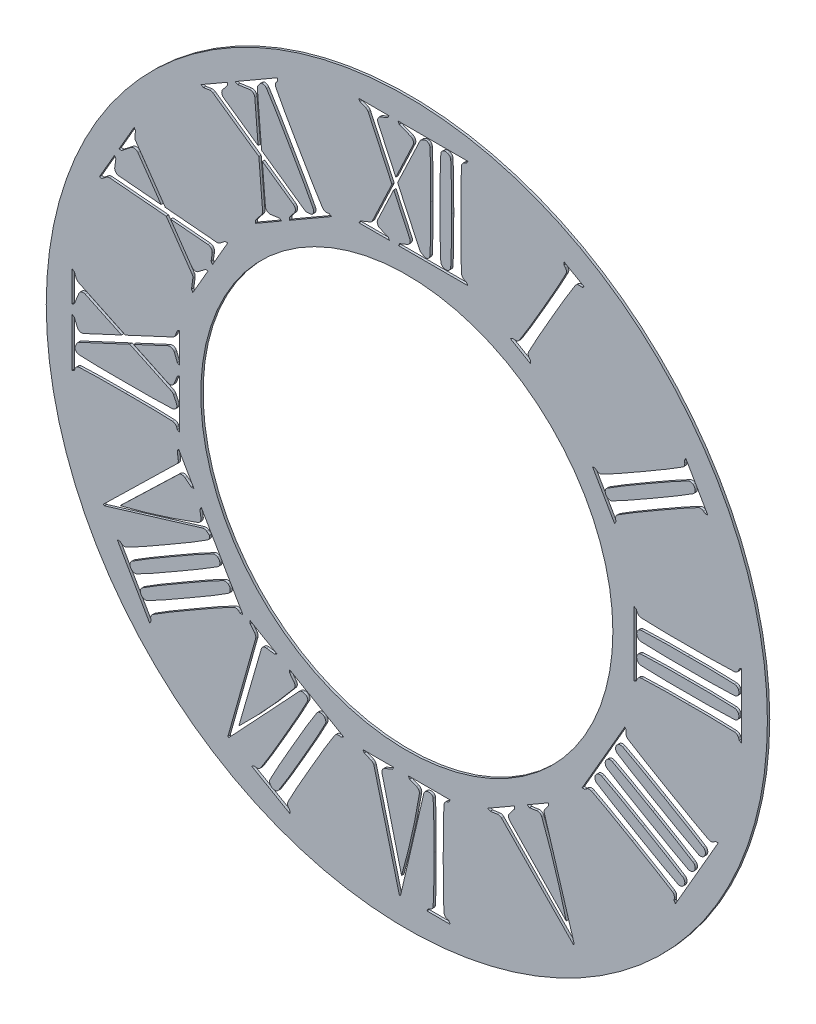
SolidWorks part; units mm, degrees
ref_plane "Спереди" through (0, 0, 0) normal (0, 0, 1) x (1, 0, 0)
ref_plane "Сверху" through (0, 0, 0) normal (0, 1, 0) x (1, 0, 0)
ref_plane "Справа" through (0, 0, 0) normal (1, 0, 0) x (0, 0, -1)
sketch "Эскиз2" plane through (0, 0, 0) normal (0, 0, 1) x (1, 0, 0)
  line L0 (0, 0) -> (30, 51.9615) construction
  line L1 (0, 0) -> (0, 77) construction
  line L2 (36.3522, 20.2743) -> (51.3986, 27.9408) construction
  line L3 (0, 0) -> (51.9615, -30) construction
  line L6 (33.5849, 63.1708) -> (33.5849, 62.5935)
  line L17 (37.4151, 60.3821) -> (36.9495, 60.4476)
  line L18 (24.25, 42.0022) -> (35.75, 61.9208) construction
  line L19 (33.5849, 63.1708) -> (37.9151, 60.6708)
  line L20 (22.0849, 43.2522) -> (22.5849, 43.5409)
  line L21 (33.5849, 62.5935) -> (33.8744, 62.223)
  line L22 (22.5849, 43.5409) -> (23.0505, 43.4755)
  line L23 (26.4151, 40.7522) -> (26.4151, 41.3296)
  line L24 (26.4151, 41.3296) -> (26.1256, 41.7001)
  line L25 (37.9151, 60.6708) -> (37.4151, 60.3821)
  line L26 (29.134, 52.4615) -> (30, 51.9615) construction
  line L27 (22.0849, 43.2522) -> (26.4151, 40.7522)
  line L28 (29, 49.5046) -> (29, 54.6308) construction
  line L29 (30.2438, 54.3838) -> (27.6807, 49.9445) construction
  line L30 (19.4297, 36.8398) -> (28.627, 51.0024) construction
  line L31 (40.8966, 26.1651) -> (60.8152, 37.6651) construction
  line L32 (62.0652, 35.5) -> (61.4878, 35.5) construction
  line L33 (39.6466, 28.3301) -> (42.1466, 24) construction
  line L34 (61.4878, 35.5) -> (61.1173, 35.7895) construction
  line L35 (59.5652, 39.8301) -> (59.2765, 39.3301)
  line L36 (40.2239, 28.3301) -> (40.5944, 28.0407)
  line L37 (42.1466, 24) -> (42.4352, 24.5) construction
  line L38 (39.6466, 28.3301) -> (40.2239, 28.3301)
  line L39 (59.2765, 39.3301) -> (59.3419, 38.8645)
  line L40 (42.4352, 24.5) -> (42.3698, 24.9656) construction
  line L41 (59.5652, 39.8301) -> (62.0652, 35.5) construction
  line L42 (50.3559, 32.7811) -> (50.8559, 31.9151) construction
  line L43 (28.134, 104.2991) -> (28.134, 109.4252) construction
  line L44 (41.8579, 24.5) -> (44.3579, 20.1699) construction
  line L45 (44.3579, 20.1699) -> (44.6466, 20.6699)
  line L46 (43.1079, 22.3349) -> (63.0265, 33.8349) construction
  line L47 (61.7765, 36) -> (64.2765, 31.6699) construction
  line L48 (61.7765, 36) -> (61.4878, 35.5) construction
  line L49 (63.6991, 31.6699) -> (63.3286, 31.9593)
  line L50 (42.4352, 24.5) -> (42.8057, 24.2105) construction
  line L51 (44.6466, 20.6699) -> (44.5811, 21.1355)
  line L52 (64.2765, 31.6699) -> (63.6991, 31.6699)
  line L53 (52.5672, 28.951) -> (53.0672, 28.0849) construction
  line L54 (41.8579, 24.5) -> (42.4352, 24.5) construction
  line L55 (61.4878, 35.5) -> (61.5532, 35.0344) construction
  line L56 (39.6466, 28.3301) -> (44.3579, 20.1699)
  line L57 (59.5652, 39.8301) -> (64.2765, 31.6699)
  line L58 (51.3559, 31.049) -> (52.5672, 28.951) construction
  line L59 (0, 0) -> (51.9615, 30) construction
  line L60 (51.4573, 28.3102) -> (55.8967, 30.8733) construction
  line L61 (49.246, 32.1403) -> (53.6854, 34.7034) construction
  line L62 (0, 0) -> (60, 0) construction
  line L63 (48.5, 2.5) -> (48.5, -2.5) construction
  line L64 (71.5, 2.5) -> (71.5, -2.5) construction
  line L65 (48.5, 0) -> (71.5, 0) construction
  line L66 (60, 1) -> (60, -1) construction
  line L67 (48.5, 2.5) -> (49, 2.2113) construction
  line L68 (49, 2.2113) -> (49.1761, 1.7754) construction
  line L69 (63.17, 1) -> (56.8288, 1) construction
  line L70 (59.7212, 0.6446) -> (34.8048, 1.9504) construction
  line L71 (71, 2.2113) -> (70.8239, 1.7754) construction
  line L72 (71.5, 2.5) -> (71, 2.2113) construction
  line L73 (71.5, -2.5) -> (71, -2.2113) construction
  line L74 (71, -2.2113) -> (70.8239, -1.7754) construction
  line L75 (59, -2.4569) -> (59, 2.6692) construction
  line L76 (49, -2.2113) -> (49.1761, -1.7754) construction
  line L77 (48.5, -2.5) -> (49, -2.2113) construction
  line L78 (34.1408, 24.1044) -> (49.1873, 31.7709) construction
  line L79 (49.1362, 29.7675) -> (53.5755, 32.3306) construction
  line L80 (71, 2.2113) -> (70.8239, 2.6473) construction
  line L81 (48.5, 4.4226) -> (71.5, 4.4226) construction
  line L82 (60, 5.4226) -> (60, 3.4226) construction
  line L83 (48.5, 6.9226) -> (48.5, 1.9226) construction
  line L84 (49, 2.2113) -> (49.1761, 2.6473) construction
  line L85 (71.5, 1.9226) -> (71, 2.2113) construction
  line L86 (48.5, 6.9226) -> (49, 6.634)
  line L87 (49, 6.634) -> (49.1761, 6.198)
  line L88 (71.5, 6.9226) -> (71, 6.634)
  line L89 (71.5, 6.9226) -> (71.5, 1.9226) construction
  line L90 (71, 6.634) -> (70.8239, 6.198)
  line L91 (48.5, 1.9226) -> (49, 2.2113) construction
  line L92 (62.5092, 3.9242) -> (37.5928, 2.6184) construction
  line L93 (62.5092, 4.9211) -> (37.5928, 6.2269) construction
  line L94 (62.1137, 5.4226) -> (57.8863, 5.4226) construction
  line L95 (62.1137, 3.4226) -> (57.8863, 3.4226) construction
  line L96 (71.5, -6.9226) -> (71, -6.634)
  line L97 (71, -6.634) -> (70.8239, -6.198)
  line L98 (49, -6.634) -> (49.1761, -6.198)
  line L99 (48.5, -6.9226) -> (49, -6.634)
  line L100 (71.5, 6.9226) -> (71.5, -6.9226)
  line L101 (48.5, 6.9226) -> (48.5, -6.9226)
  line L102 (48.5, -4.4226) -> (71.5, -4.4226) construction
  line L103 (57.4908, -3.9242) -> (82.4072, -2.6184) construction
  line L104 (62.5092, -3.9242) -> (37.5928, -2.6184) construction
  line L105 (62.1137, -3.4226) -> (57.8863, -3.4226) construction
  line L106 (44.3579, -20.1699) -> (44.6466, -20.6699) construction
  line L107 (44.6466, -20.6699) -> (44.5811, -21.1355) construction
  line L108 (42.4352, -24.5) -> (42.8057, -24.2105) construction
  line L109 (42.4352, -24.5) -> (42.3698, -24.9656) construction
  line L110 (42.1466, -24) -> (42.4352, -24.5) construction
  line L111 (41.8579, -24.5) -> (42.4352, -24.5) construction
  line L112 (37.4352, -32.1603) -> (46.5692, -16.3397)
  line L113 (39.6466, -28.3301) -> (40.2239, -28.3301) construction
  line L114 (40.2239, -28.3301) -> (40.5944, -28.0407) construction
  line L115 (0, 0) -> (51.9615, -30) construction
  line L116 (52.5672, -28.951) -> (53.0672, -28.0849) construction
  line L117 (51.3559, -31.049) -> (52.5672, -28.951) construction
  line L118 (50.3559, -32.7811) -> (50.8559, -31.9151) construction
  line L119 (64.2765, -31.6699) -> (63.6991, -31.6699) construction
  line L120 (63.6991, -31.6699) -> (63.3286, -31.9593) construction
  line L121 (43.1079, -22.3349) -> (63.0265, -33.8349) construction
  line L122 (62.0652, -35.5) -> (61.4878, -35.5) construction
  line L123 (61.4878, -35.5) -> (61.5532, -35.0344) construction
  line L124 (61.7765, -36) -> (61.4878, -35.5) construction
  line L125 (61.4878, -35.5) -> (61.1173, -35.7895) construction
  line L126 (40.8966, -26.1651) -> (60.8152, -37.6651) construction
  line L127 (57.3538, -43.6603) -> (66.4878, -27.8397)
  line L128 (59.2765, -39.3301) -> (59.3419, -38.8645) construction
  line L129 (59.5652, -39.8301) -> (59.2765, -39.3301) construction
  line L130 (46.5692, -16.3397) -> (46.8579, -16.8397)
  line L131 (46.8579, -16.8397) -> (46.7925, -17.3053)
  line L132 (66.4878, -27.8397) -> (65.9105, -27.8397)
  line L133 (65.9105, -27.8397) -> (65.54, -28.1292)
  line L134 (57.3538, -43.6603) -> (57.0652, -43.1603)
  line L135 (57.0652, -43.1603) -> (57.1306, -42.6947)
  line L136 (37.4352, -32.1603) -> (38.0126, -32.1603)
  line L137 (38.0126, -32.1603) -> (38.3831, -31.8708)
  line L138 (0, 0) -> (0, -71.5) construction
  line L139 (0, 0) -> (35.75, -61.9208) construction
  circle A0 centre (0, 0) radius 44
  circle A1 centre (0, 0) radius 77
  circle A2 centre (0, 0) radius 48.5 construction
  circle A3 centre (0, 0) radius 71.5 construction
  circle A8 centre (0, 0) radius 60 construction
  arc A9 (23.0505, 43.4755) -> (24.0284, 43.9211) centre (23.1897, 44.4657) ccw
  arc A10 (26.1256, 41.7001) -> (26.0226, 42.7697) centre (26.9136, 42.3157) cw
  arc A11 (33.8744, 62.223) -> (33.9774, 61.1533) centre (33.0864, 61.6073) cw
  arc A12 (36.9495, 60.4476) -> (35.9716, 60.0019) centre (36.8103, 59.4573) ccw
  arc A13 (61.1173, 35.7895) -> (60.0477, 35.8925) centre (60.5016, 35.0015) ccw
  arc A14 (40.5944, 28.0407) -> (41.6641, 27.9377) centre (41.2101, 28.8287) ccw
  arc A15 (59.3419, 38.8645) -> (58.8963, 37.8867) centre (58.3516, 38.7254) cw
  arc A16 (42.3698, 24.9656) -> (42.8154, 25.9434) centre (43.3601, 25.1048) cw
  arc A17 (44.5811, 21.1355) -> (45.0268, 22.1133) centre (45.5714, 21.2746) cw
  arc A18 (61.5532, 35.0344) -> (61.1076, 34.0566) centre (60.563, 34.8952) cw
  arc A19 (42.8057, 24.2105) -> (43.8754, 24.1075) centre (43.4214, 24.9985) ccw
  arc A20 (63.3286, 31.9593) -> (62.259, 32.0623) centre (62.713, 31.1713) ccw
  arc A21 (49.1761, 1.7754) -> (50.051, 1.1514) centre (50.1033, 2.15) ccw
  arc A22 (70.8239, 1.7754) -> (69.949, 1.1514) centre (69.8967, 2.15) cw
  arc A23 (70.8239, -1.7754) -> (69.949, -1.1514) centre (69.8967, -2.15) ccw
  arc A24 (49.1761, -1.7754) -> (50.051, -1.1514) centre (50.1033, -2.15) cw
  arc A25 (70.8239, 6.198) -> (69.949, 5.574) centre (69.8967, 6.5726) cw
  arc A26 (49.1761, 2.6473) -> (50.051, 3.2713) centre (50.1033, 2.2726) cw
  arc A27 (70.8239, 2.6473) -> (69.949, 3.2713) centre (69.8967, 2.2726) ccw
  arc A28 (49.1761, 6.198) -> (50.051, 5.574) centre (50.1033, 6.5726) ccw
  arc A29 (70.8239, -2.6473) -> (69.949, -3.2713) centre (69.8967, -2.2726) cw
  arc A30 (49.1761, -2.6473) -> (50.051, -3.2713) centre (50.1033, -2.2726) ccw
  arc A31 (70.8239, -6.198) -> (69.949, -5.574) centre (69.8967, -6.5726) ccw
  arc A32 (49.1761, -6.198) -> (50.051, -5.574) centre (50.1033, -6.5726) cw
  arc A33 (44.5811, -21.1355) -> (45.0268, -22.1133) centre (45.5714, -21.2746) ccw
  arc A34 (42.8057, -24.2105) -> (43.8754, -24.1075) centre (43.4214, -24.9985) cw
  arc A35 (42.3698, -24.9656) -> (42.8154, -25.9434) centre (43.3601, -25.1048) ccw
  arc A36 (40.5944, -28.0407) -> (41.6641, -27.9377) centre (41.2101, -28.8287) cw
  arc A37 (63.3286, -31.9593) -> (62.259, -32.0623) centre (62.713, -31.1713) cw
  arc A38 (61.5532, -35.0344) -> (61.1076, -34.0566) centre (60.563, -34.8952) ccw
  arc A39 (61.1173, -35.7895) -> (60.0477, -35.8925) centre (60.5016, -35.0015) cw
  arc A40 (59.3419, -38.8645) -> (58.8963, -37.8867) centre (58.3516, -38.7254) ccw
  arc A41 (46.7925, -17.3053) -> (47.2381, -18.2832) centre (47.7827, -17.4445) ccw
  arc A42 (65.54, -28.1292) -> (64.4703, -28.2322) centre (64.9243, -27.3412) cw
  arc A43 (63.7646, -31.2043) -> (63.3189, -30.2264) centre (62.7743, -31.0651) ccw
  arc A44 (45.0171, -20.3804) -> (46.0867, -20.2774) centre (45.6327, -21.1684) cw
  arc A45 (58.906, -39.6196) -> (57.8363, -39.7226) centre (58.2903, -38.8316) cw
  arc A46 (57.1306, -42.6947) -> (56.685, -41.7168) centre (56.1403, -42.5555) ccw
  arc A47 (38.3831, -31.8708) -> (39.4527, -31.7678) centre (38.9988, -32.6588) cw
  arc A48 (40.1585, -28.7957) -> (40.6041, -29.7736) centre (41.1488, -28.9349) ccw
  spline S0 degree 3 poles (42.3698, -24.9656) (42.4103, -24.6778) (42.5455, -24.4139) (42.8057, -24.2105) knots 0 0 0 0 1 1 1 1
  spline S1 degree 3 poles (53.5672, -27.2189) (50.7926, -25.617) (47.3872, -23.6462) (45.0268, -22.1133) knots 0 0 0 0 1 1 1 1
  spline S2 degree 3 poles (50.3559, -32.7811) (47.5813, -31.1792) (44.1718, -29.2154) (41.6641, -27.9377) knots 0 0 0 0 1 1 1 1
  spline S3 degree 3 poles (51.3559, -31.049) (48.5813, -29.4471) (45.1759, -27.4763) (42.8154, -25.9434) knots 0 0 0 0 1 1 1 1
  spline S4 degree 3 poles (30.866, 51.4615) (32.4679, 54.2361) (34.4387, 57.6415) (35.9716, 60.0019) knots 0 0 0 0 1 1 1 1
  spline S5 degree 3 poles (30.866, 51.4615) (29.2641, 48.6869) (27.3004, 45.2775) (26.0226, 42.7697) knots 0 0 0 0 1 1 1 1
  spline S6 degree 3 poles (29.134, 52.4615) (27.5321, 49.6869) (25.5613, 46.2815) (24.0284, 43.9211) knots 0 0 0 0 1 1 1 1
  spline S7 degree 3 poles (29.134, 52.4615) (30.7359, 55.2361) (32.6996, 58.6456) (33.9774, 61.1533) knots 0 0 0 0 1 1 1 1
  spline S8 degree 3 poles (50.3559, 32.7811) (47.5813, 31.1792) (44.1718, 29.2154) (41.6641, 27.9377) knots 0 0 0 0 1 1 1 1
  spline S9 degree 3 poles (51.3559, 31.049) (48.5813, 29.4471) (45.1759, 27.4763) (42.8154, 25.9434) knots 0 0 0 0 1 1 1 1
  spline S10 degree 3 poles (51.3559, 31.049) (54.1305, 32.651) (57.5399, 34.6147) (60.0477, 35.8925) knots 0 0 0 0 1 1 1 1
  spline S11 degree 3 poles (50.3559, 32.7811) (53.1305, 34.383) (56.5358, 36.3538) (58.8963, 37.8867) knots 0 0 0 0 1 1 1 1
  spline S12 degree 3 poles (52.5672, 28.951) (55.3418, 30.5529) (58.7472, 32.5237) (61.1076, 34.0566) knots 0 0 0 0 1 1 1 1
  spline S13 degree 3 poles (53.5672, 27.2189) (50.7926, 25.617) (47.3872, 23.6462) (45.0268, 22.1133) knots 0 0 0 0 1 1 1 1
  spline S14 degree 3 poles (52.5672, 28.951) (49.7926, 27.349) (46.3831, 25.3853) (43.8754, 24.1075) knots 0 0 0 0 1 1 1 1
  spline S15 degree 3 poles (53.5672, 27.2189) (56.3418, 28.8208) (59.7512, 30.7846) (62.259, 32.0623) knots 0 0 0 0 1 1 1 1
  spline S16 degree 3 poles (42.3698, 24.9656) (42.4103, 24.6778) (42.5455, 24.4139) (42.8057, 24.2105) knots 0 0 0 0 1 1 1 1
  spline S17 degree 3 poles (61.1173, 35.7895) (61.3463, 35.6105) (61.5073, 35.3614) (61.5532, 35.0344) knots 0 0 0 0 1 1 1 1
  spline S18 degree 3 poles (50.051, 1.1514) (54.2037, 0.9337) (57.3578, 1) (60, 1) knots 0 0 0 0 1 1 1 1
  spline S19 degree 3 poles (69.949, 1.1514) (65.7963, 0.9337) (62.6422, 1) (60, 1) knots 0 0 0 0 1 1 1 1
  spline S20 degree 3 poles (69.949, -1.1514) (65.7963, -0.9337) (62.6422, -1) (60, -1) knots 0 0 0 0 1 1 1 1
  spline S21 degree 3 poles (50.051, -1.1514) (54.2037, -0.9337) (57.3578, -1) (60, -1) knots 0 0 0 0 1 1 1 1
  spline S22 degree 3 poles (50.051, 5.574) (54.2037, 5.3564) (57.3578, 5.4226) (60, 5.4226) knots 0 0 0 0 1 1 1 1
  spline S23 degree 3 poles (50.051, 3.2713) (54.2037, 3.4889) (57.3578, 3.4226) (60, 3.4226) knots 0 0 0 0 1 1 1 1
  spline S24 degree 3 poles (69.949, 3.2713) (65.7963, 3.4889) (62.6422, 3.4226) (60, 3.4226) knots 0 0 0 0 1 1 1 1
  spline S25 degree 3 poles (69.949, 5.574) (65.7963, 5.3564) (62.6422, 5.4226) (60, 5.4226) knots 0 0 0 0 1 1 1 1
  spline S26 degree 3 poles (49.1761, 1.7754) (49.0673, 2.0449) (49.0524, 2.3411) (49.1761, 2.6473) knots 0 0 0 0 1 1 1 1
  spline S27 degree 3 poles (70.8239, 1.7754) (70.9327, 2.0449) (70.9476, 2.3411) (70.8239, 2.6473) knots 0 0 0 0 1 1 1 1
  spline S28 degree 3 poles (70.8239, -1.7754) (70.9327, -2.0449) (70.9476, -2.3411) (70.8239, -2.6473) knots 0 0 0 0 1 1 1 1
  spline S29 degree 3 poles (69.949, -3.2713) (65.7963, -3.4889) (62.6422, -3.4226) (60, -3.4226) knots 0 0 0 0 1 1 1 1
  spline S30 degree 3 poles (50.051, -3.2713) (54.2037, -3.4889) (57.3578, -3.4226) (60, -3.4226) knots 0 0 0 0 1 1 1 1
  spline S31 degree 3 poles (49.1761, -1.7754) (49.0673, -2.0449) (49.0524, -2.3411) (49.1761, -2.6473) knots 0 0 0 0 1 1 1 1
  spline S32 degree 3 poles (69.949, -5.574) (65.7963, -5.3564) (62.6422, -5.4226) (60, -5.4226) knots 0 0 0 0 1 1 1 1
  spline S33 degree 3 poles (50.051, -5.574) (54.2037, -5.3564) (57.3578, -5.4226) (60, -5.4226) knots 0 0 0 0 1 1 1 1
  spline S34 degree 3 poles (52.5672, -28.951) (49.7926, -27.349) (46.3831, -25.3853) (43.8754, -24.1075) knots 0 0 0 0 1 1 1 1
  spline S35 degree 3 poles (53.5672, -27.2189) (56.3418, -28.8208) (59.7512, -30.7846) (62.259, -32.0623) knots 0 0 0 0 1 1 1 1
  spline S36 degree 3 poles (52.5672, -28.951) (55.3418, -30.5529) (58.7472, -32.5237) (61.1076, -34.0566) knots 0 0 0 0 1 1 1 1
  spline S37 degree 3 poles (61.1173, -35.7895) (61.3463, -35.6105) (61.5073, -35.3614) (61.5532, -35.0344) knots 0 0 0 0 1 1 1 1
  spline S38 degree 3 poles (51.3559, -31.049) (54.1305, -32.651) (57.5399, -34.6147) (60.0477, -35.8925) knots 0 0 0 0 1 1 1 1
  spline S39 degree 3 poles (50.3559, -32.7811) (53.1305, -34.383) (56.5358, -36.3538) (58.8963, -37.8867) knots 0 0 0 0 1 1 1 1
  spline S40 degree 3 poles (55.7785, -23.3888) (53.0039, -21.7869) (49.5985, -19.8161) (47.2381, -18.2832) knots 0 0 0 0 1 1 1 1
  spline S41 degree 3 poles (55.7785, -23.3888) (58.5531, -24.9907) (61.9626, -26.9544) (64.4703, -28.2322) knots 0 0 0 0 1 1 1 1
  spline S42 degree 3 poles (63.7646, -31.2043) (63.7241, -31.4921) (63.5889, -31.756) (63.3286, -31.9593) knots 0 0 0 0 1 1 1 1
  spline S43 degree 3 poles (45.0171, -20.3804) (44.7881, -20.5593) (44.6271, -20.8084) (44.5811, -21.1355) knots 0 0 0 0 1 1 1 1
  spline S44 degree 3 poles (54.7785, -25.1208) (57.5531, -26.7228) (60.9585, -28.6935) (63.3189, -30.2264) knots 0 0 0 0 1 1 1 1
  spline S45 degree 3 poles (54.7785, -25.1208) (52.0039, -23.5189) (48.5945, -21.5552) (46.0867, -20.2774) knots 0 0 0 0 1 1 1 1
  spline S46 degree 3 poles (59.3419, -38.8645) (59.3015, -39.1523) (59.1662, -39.4163) (58.906, -39.6196) knots 0 0 0 0 1 1 1 1
  spline S47 degree 3 poles (40.5944, -28.0407) (40.3654, -28.2196) (40.2044, -28.4687) (40.1585, -28.7957) knots 0 0 0 0 1 1 1 1
  spline S48 degree 3 poles (48.1445, -36.6112) (50.9191, -38.2131) (54.3245, -40.1839) (56.685, -41.7168) knots 0 0 0 0 1 1 1 1
  spline S49 degree 3 poles (49.1445, -34.8792) (51.9191, -36.4811) (55.3286, -38.4448) (57.8363, -39.7226) knots 0 0 0 0 1 1 1 1
  spline S50 degree 3 poles (49.1445, -34.8792) (46.3699, -33.2772) (42.9646, -31.3065) (40.6041, -29.7736) knots 0 0 0 0 1 1 1 1
  spline S51 degree 3 poles (48.1445, -36.6112) (45.3699, -35.0093) (41.9605, -33.0456) (39.4527, -31.7678) knots 0 0 0 0 1 1 1 1
  point P100 (51.9615, 30)
  dimension "D1" = 88
  dimension "D2" = 154
  dimension "D12" = 97
  dimension "D13" = 143
  dimension "D14" = 120
  dimension "D20" = 1
  dimension "D21" = 3
  dimension "D29" = 2
  dimension "D37" = 2
  dimension "D40" = 23
  dimension "D41" = 2
  dimension "D48" = 3
  dimension "D43" = 2
  dimension "D49" = 3
  dimension "D50" = 2
  dimension "D51" = 2
  dimension "D55" = 3
  dimension "D56" = 3
  dimension "D58" = 3
  dimension "D59" = 3
  dimension "D6" = 3
  dimension "D3" = 30
  dimension "D7" = 30
  dimension "D16" = 5
  dimension "D17" = 60
  dimension "D18" = 22
  dimension "D19" = 0.5
  dimension "D22" = 1
  dimension "D23" = 2.15
  dimension "D24" = 30
  dimension "D25" = 2.5
  dimension "D26" = 60
  dimension "D27" = 22
  dimension "D28" = 0.5
  dimension "D30" = 2.15
  dimension "D31" = 1
  dimension "D32" = 23
  dimension "D33" = 2.5
  dimension "D34" = 60
  dimension "D35" = 22
  dimension "D36" = 0.5
  dimension "D38" = 2.15
  dimension "D39" = 1
  dimension "D42" = 5
  dimension "D44" = 60
  dimension "D45" = 22
  dimension "D46" = 0.5
  dimension "D47" = 2.15
  dimension "D52" = 60
  dimension "D53" = 22
  dimension "D54" = 0.5
  dimension "D57" = 4.4226
extrude "Бобышка-Вытянуть1" add sketch "Эскиз2" along normal blind 0.5
sketch "Эскиз3" plane through (0, 0, 0.5) normal (0, 0, 1) x (1, 0, 0)
  line L0 (0, 0) -> (0, -71.5) construction
  line L1 (0, 0) -> (35.75, -61.9208) construction
  line L2 (35.75, -61.9208) -> (35.5732, -62.0976)
  line L3 (20.2308, -46.3756) -> (35.5732, -62.0976)
  line L4 (35.75, -61.9208) -> (29.3692, -40.9192)
  line L5 (34.0343, -58.5022) -> (21.991, -45.9873)
  line L6 (35.75, -61.9208) -> (34.0343, -58.5022) construction
  line L7 (17.296, -46.0171) -> (30.2301, -38.5496) construction
  line L8 (17.296, -46.0171) -> (22.9988, -42.7246)
  line L9 (17.296, -46.0171) -> (17.796, -46.3058)
  line L10 (4.2733, -71.5) -> (4.5619, -71)
  line L11 (22.9988, -42.7246) -> (22.9988, -43.302)
  line L12 (22.9988, -43.302) -> (21.9235, -44.6782)
  line L13 (17.796, -46.3058) -> (19.3759, -46.0837)
  line L14 (25.6835, -41.1746) -> (30.2301, -38.5496)
  line L15 (25.6835, -41.1746) -> (26.1835, -41.4633)
  line L16 (26.1835, -41.4633) -> (27.7579, -41.242)
  line L17 (30.2301, -38.5496) -> (30.2301, -39.127)
  line L18 (30.2301, -39.127) -> (29.538, -40.0128)
  line L19 (-1.35, -71.4873) -> (3.6213, -50.1244)
  line L20 (-1.35, -71.4873) -> (-1.5915, -71.552)
  line L21 (-1.5915, -71.552) -> (-7.0142, -50.2778)
  line L22 (-1.35, -71.4873) -> (-1.35, -48.4812) construction
  line L23 (-1.35, -71.4873) -> (-1.1265, -67.6688) construction
  line L24 (-1.1265, -67.6688) -> (-5.2957, -50.8217)
  line L25 (4.5619, -71) -> (4.9979, -70.8239)
  line L26 (-9.3765, -48.5) -> (5.5585, -48.5) construction
  line L27 (-2.7915, -48.5) -> (-9.3765, -48.5)
  line L28 (-9.3765, -48.5) -> (-9.0878, -49)
  line L29 (-9.0878, -49) -> (-7.6086, -49.5976)
  line L30 (-2.7915, -48.5) -> (-3.0802, -49)
  line L31 (-3.0802, -49) -> (-4.6996, -49.6543)
  line L32 (0.3085, -48.5) -> (5.5585, -48.5)
  line L33 (0.3085, -48.5) -> (0.5972, -49)
  line L34 (0.5972, -49) -> (2.0663, -49.5936)
  line L35 (5.5585, -48.5) -> (5.2698, -49) construction
  line L36 (5.2698, -49) -> (4.2207, -49.4239) construction
  line L37 (6.7732, -48.5) -> (6.7733, -71.5) construction
  line L38 (5.5585, -48.5) -> (9.2733, -48.5)
  line L39 (4.5619, -49) -> (4.9979, -49.1761) construction
  line L40 (8.9846, -49) -> (8.5486, -49.1761)
  line L41 (4.2733, -71.5) -> (9.2733, -71.5)
  line L42 (6.7733, -60) -> (7.7733, -60) construction
  line L43 (9.2733, -71.5) -> (8.9846, -71)
  line L44 (8.9846, -71) -> (8.5486, -70.8239)
  line L45 (7.4039, -60.0137) -> (8.4706, -80.3666) construction
  line L46 (7.7733, -49.7982) -> (7.7733, -70.2018) construction
  line L47 (9.2733, -48.5) -> (8.9846, -49)
  line L48 (4.2733, -48.5) -> (4.5619, -49) construction
  line L49 (0, 0) -> (-35.75, -61.9208) construction
  line L50 (-33.448, -36.6918) -> (-13.4743, -48.2236) construction
  line L51 (-19.4695, -44.7622) -> (-30.9695, -64.6808) construction
  line L52 (-21.6346, -43.5122) -> (-17.3045, -46.0122) construction
  line L53 (-33.1346, -63.4308) -> (-28.8045, -65.9308) construction
  line L54 (-25.2195, -54.7215) -> (-26.0856, -54.2215) construction
  line L55 (-36.5902, -71.0757) -> (-25.7767, -54.4243) construction
  line L56 (-33.1346, -63.4308) -> (-32.6346, -63.1421)
  line L57 (-32.6346, -63.1421) -> (-32.169, -63.2076)
  line L58 (-26.0856, -54.2215) -> (-37.2842, -71.4658) construction
  line L59 (-31.0597, -62.837) -> (-21.0729, -45.5394) construction
  line L60 (-21.6346, -44.0896) -> (-21.3451, -44.4601) construction
  line L61 (-21.6346, -43.5122) -> (-21.6346, -44.0896) construction
  line L62 (-28.8045, -65.9308) -> (-28.8045, -65.3535) construction
  line L63 (-28.8045, -65.3535) -> (-29.0939, -64.983) construction
  line L64 (-17.8045, -46.3009) -> (-18.2701, -46.2355) construction
  line L65 (-17.3045, -46.0122) -> (-17.8045, -46.3009) construction
  line L66 (-17.8045, -45.7236) -> (-13.4743, -48.2236) construction
  line L67 (-13.4743, -48.2236) -> (-13.9743, -48.5122)
  line L68 (-28.8045, -65.3535) -> (-28.3389, -65.4189) construction
  line L69 (-17.8045, -45.7236) -> (-17.8045, -46.3009) construction
  line L70 (-29.3045, -65.6421) -> (-24.9743, -68.1421) construction
  line L71 (-24.9743, -68.1421) -> (-24.9743, -67.5648)
  line L72 (-17.8045, -46.3009) -> (-17.515, -46.6714) construction
  line L73 (-13.9743, -48.5122) -> (-14.4399, -48.4468)
  line L74 (-29.3045, -65.6421) -> (-28.8045, -65.3535) construction
  line L75 (-24.9743, -67.5648) -> (-25.2638, -67.1943)
  line L76 (-27.1394, -66.8921) -> (-15.6394, -46.9736) construction
  line L77 (-32.7678, -73.299) -> (-21.9543, -56.6476) construction
  line L78 (-29.8262, -74.8767) -> (-20.8125, -57.1863) construction
  line L79 (-23.587, -58.7392) -> (-20.9239, -54.1265) construction
  line L80 (-21.3894, -56.9328) -> (-22.2554, -56.4328) construction
  line L81 (-21.3894, -56.9328) -> (-20.5234, -57.4328) construction
  line L82 (-21.855, -59.7392) -> (-19.1918, -55.1265) construction
  line L83 (-10.011, -40.5667) -> (-20.8245, -57.2181) construction
  line L84 (-12.9051, -38.8958) -> (-21.9189, -56.5863) construction
  line L85 (-23.587, -58.7392) -> (-20.9239, -54.1265) construction
  line L86 (-19.1918, -55.1265) -> (-21.855, -59.7392) construction
  line L87 (-21.6346, -43.5122) -> (-13.4743, -48.2236)
  line L88 (-33.1346, -63.4308) -> (-24.9743, -68.1421)
  line L89 (-26.5045, -40.7006) -> (-37.9808, -60.5781) construction
  line L90 (-37.9808, -60.5781) -> (-38.2223, -60.5134)
  line L91 (-38.2223, -60.5134) -> (-32.2911, -39.4126)
  line L92 (-37.9808, -60.5781) -> (-23.0237, -44.5947)
  line L93 (-37.9808, -60.5781) -> (-35.878, -57.383) construction
  line L94 (-35.878, -57.383) -> (-31.075, -40.7428)
  line L95 (-33.448, -36.6918) -> (-27.7452, -39.9843)
  line L96 (-33.448, -36.6918) -> (-33.448, -37.2691)
  line L97 (-33.448, -37.2691) -> (-32.4658, -38.5263)
  line L98 (-27.7452, -39.9843) -> (-28.2452, -40.2729)
  line L99 (-28.2452, -40.2729) -> (-29.9751, -40.0298)
  line L100 (-25.0605, -41.5343) -> (-20.5139, -44.1593) construction
  line L101 (-25.0605, -41.5343) -> (-25.0605, -42.1116)
  line L102 (-25.0605, -42.1116) -> (-24.0941, -43.3486)
  line L103 (-20.5139, -44.1593) -> (-21.0139, -44.4479) construction
  line L104 (-21.0139, -44.4479) -> (-22.1544, -44.2877) construction
  line L105 (-25.0605, -41.5343) -> (-21.6346, -43.5122)
  line L106 (0, 0) -> (-61.9208, -35.75) construction
  line L107 (-48.9844, -12.1565) -> (-34.9909, -36.394) construction
  line L108 (-46.7365, -39.5771) -> (-29.583, -28.4375) construction
  line L109 (-46.1204, -40.6443) -> (-27.8964, -31.3587) construction
  line L110 (-38.4522, -30.3988) -> (-58.3708, -41.8988) construction
  line L111 (-59.6208, -39.7337) -> (-57.1208, -44.0638) construction
  line L112 (-48.4115, -36.1488) -> (-48.9115, -35.2828) construction
  line L113 (-59.6208, -39.7337) -> (-59.0435, -39.7337) construction
  line L114 (-59.0435, -39.7337) -> (-58.673, -40.0232) construction
  line L115 (-46.2421, -34.3374) -> (-64.466, -43.6229) construction
  line L116 (-40.4865, -30.4186) -> (-57.2671, -40.1068) construction
  line L117 (-48.4914, -35.4834) -> (-66.7153, -44.769) construction
  line L118 (-39.7022, -28.2337) -> (-39.9909, -28.7337) construction
  line L119 (-39.9909, -28.7337) -> (-39.9255, -29.1993) construction
  line L120 (-57.1208, -44.0638) -> (-56.8321, -43.5638) construction
  line L121 (-56.8321, -43.5638) -> (-56.8976, -43.0983) construction
  line L122 (-37.2022, -32.5638) -> (-37.7796, -32.5638) construction
  line L123 (-37.7796, -32.5638) -> (-38.1501, -32.2744) construction
  line L124 (-36.2409, -34.2289) -> (-56.1595, -45.7289) construction
  line L125 (-54.6208, -47.394) -> (-54.6863, -46.9284)
  line L126 (-57.4095, -43.5638) -> (-56.8321, -43.5638) construction
  line L127 (-35.5683, -36.394) -> (-35.9388, -36.1045)
  line L128 (-56.8321, -43.5638) -> (-56.4616, -43.8533) construction
  line L129 (-37.7796, -32.5638) -> (-37.7141, -33.0294) construction
  line L130 (-57.4095, -43.5638) -> (-54.9095, -47.894) construction
  line L131 (-37.4909, -32.0638) -> (-37.7796, -32.5638) construction
  line L132 (-54.9095, -47.894) -> (-54.6208, -47.394)
  line L133 (-34.9909, -36.394) -> (-35.5683, -36.394)
  line L134 (-48.9376, -40.4047) -> (-44.4628, -37.8211) construction
  line L135 (-46.2002, -39.9789) -> (-46.7002, -39.1129) construction
  line L136 (-43.4628, -39.5532) -> (-47.9376, -42.1367) construction
  line L137 (-46.28, -39.3135) -> (-64.504, -48.5991) construction
  line L138 (-45.6639, -40.3807) -> (-62.8174, -51.5203) construction
  line L139 (-46.2002, -39.9789) -> (-45.7002, -40.8449) construction
  line L140 (-43.4628, -39.5532) -> (-47.9376, -42.1367) construction
  line L141 (-48.9376, -40.4047) -> (-44.4628, -37.8211) construction
  line L142 (-41.9136, -24.4036) -> (-34.9909, -36.394)
  line L143 (-54.9095, -47.894) -> (-61.8321, -35.9036)
  line L144 (-41.9136, -24.4036) -> (-42.2022, -24.9036)
  line L145 (-59.3321, -40.2337) -> (-59.0435, -39.7337) construction
  line L146 (-61.2548, -35.9036) -> (-60.8843, -36.1931)
  line L147 (-61.8321, -35.9036) -> (-61.2548, -35.9036)
  line L148 (-39.4136, -28.7337) -> (-39.9909, -28.7337) construction
  line L149 (-39.9909, -28.7337) -> (-40.3614, -28.4443) construction
  line L150 (-59.0435, -39.7337) -> (-59.1089, -39.2681) construction
  line L151 (-42.2022, -24.9036) -> (-42.1368, -25.3692)
  line L152 (-40.6636, -26.5687) -> (-60.5821, -38.0687) construction
  line L153 (-50.6228, -32.3187) -> (-51.1228, -31.4526) construction
  line L154 (-50.6228, -32.3187) -> (-50.1228, -33.1847) construction
  circle A0 centre (0, 0) radius 48.5 construction
  circle A1 centre (0, 0) radius 60 construction
  circle A2 centre (0, 0) radius 71.5 construction
  arc A3 (20.2308, -46.3756) -> (19.3759, -46.0837) centre (19.5151, -47.074) ccw
  arc A4 (21.9235, -44.6782) -> (21.991, -45.9873) centre (22.7116, -45.2939) ccw
  arc A5 (34.0343, -58.5022) -> (28.8325, -41.8787) centre (-111.4799, -94.9112) ccw
  arc A6 (28.8325, -41.8787) -> (27.7579, -41.242) centre (27.8971, -42.2323) ccw
  arc A7 (29.538, -40.0128) -> (29.3692, -40.9192) centre (30.326, -40.6285) ccw
  arc A8 (-7.0142, -50.2778) -> (-7.6086, -49.5976) centre (-7.9832, -50.5248) ccw
  arc A9 (-4.6996, -49.6543) -> (-5.2957, -50.8217) centre (-4.325, -50.5815) ccw
  arc A10 (2.6785, -50.6823) -> (2.0663, -49.5936) centre (1.6917, -50.5207) ccw
  arc A11 (-1.1265, -67.6688) -> (2.6785, -50.6823) centre (-145.35, -26.4429) ccw
  arc A12 (4.2207, -49.4239) -> (3.6213, -50.1244) centre (4.5953, -50.3511) ccw
  arc A13 (7.9246, -69.949) -> (8.5486, -70.8239) centre (8.9233, -69.8967) ccw
  arc A14 (5.6219, -69.949) -> (4.9979, -70.8239) centre (4.6233, -69.8967) cw
  arc A15 (7.9246, -50.051) -> (8.5486, -49.1761) centre (8.9233, -50.1033) cw
  arc A16 (5.6219, -50.051) -> (4.9979, -49.1761) centre (4.6233, -50.1033) ccw construction
  arc A17 (-32.169, -63.2076) -> (-31.1912, -62.7619) centre (-32.0298, -62.2173) ccw
  arc A18 (-21.3451, -44.4601) -> (-21.2421, -45.5297) centre (-22.1332, -45.0757) cw construction
  arc A19 (-29.0939, -64.983) -> (-29.1969, -63.9133) centre (-28.3059, -64.3673) cw
  arc A20 (-18.2701, -46.2355) -> (-19.2479, -46.6811) centre (-18.4092, -47.2257) ccw
  arc A21 (-17.515, -46.6714) -> (-17.412, -47.7411) centre (-18.303, -47.2871) cw
  arc A22 (-25.2638, -67.1943) -> (-25.3668, -66.1246) centre (-24.4758, -66.5786) cw
  arc A23 (-14.4399, -48.4468) -> (-15.4178, -48.8924) centre (-14.5791, -49.4371) ccw
  arc A24 (-28.3389, -65.4189) -> (-27.361, -64.9733) centre (-28.1997, -64.4286) ccw
  arc A25 (-32.4658, -38.5263) -> (-32.2911, -39.4126) centre (-33.2538, -39.142) cw
  arc A26 (-29.9751, -40.0298) -> (-31.075, -40.7428) centre (-30.1142, -41.0201) ccw
  arc A27 (-22.1544, -44.2877) -> (-23.0237, -44.5947) centre (-22.2935, -45.2779) ccw
  arc A28 (-35.878, -57.383) -> (-24.1084, -44.5978) centre (-140.1662, 50.4315) ccw
  arc A29 (-58.673, -40.0232) -> (-57.6033, -40.1262) centre (-58.0573, -39.2352) ccw
  arc A30 (-24.0941, -43.3486) -> (-24.1084, -44.5978) centre (-24.8821, -43.9643) cw
  arc A31 (-39.9255, -29.1993) -> (-40.3711, -30.1772) centre (-40.9157, -29.3385) cw
  arc A32 (-56.8976, -43.0983) -> (-56.4519, -42.1204) centre (-55.9073, -42.9591) cw
  arc A33 (-38.1501, -32.2744) -> (-39.2197, -32.1714) centre (-38.7657, -33.0624) ccw
  arc A34 (-56.4616, -43.8533) -> (-55.392, -43.9563) centre (-55.846, -43.0653) ccw
  arc A35 (-37.7141, -33.0294) -> (-38.1598, -34.0073) centre (-38.7044, -33.1686) cw
  arc A36 (-35.9388, -36.1045) -> (-37.0084, -36.0015) centre (-36.5544, -36.8925) ccw
  arc A37 (-54.6863, -46.9284) -> (-54.2406, -45.9505) centre (-53.696, -46.7892) cw
  arc A38 (-40.3614, -28.4443) -> (-41.4311, -28.3413) centre (-40.9771, -29.2323) ccw
  arc A39 (-60.8843, -36.1931) -> (-59.8146, -36.296) centre (-60.2686, -35.405) ccw
  arc A40 (-59.1089, -39.2681) -> (-58.6633, -38.2903) centre (-58.1186, -39.129) cw
  arc A41 (-42.1368, -25.3692) -> (-42.5824, -26.347) centre (-43.1271, -25.5084) cw
  spline S0 degree 3 poles (7.9246, -69.949) (7.7468, -66.5569) (7.7733, -63.4006) (7.7733, -60) knots 0 0 0 0 1 1 1 1
  spline S1 degree 3 poles (5.6219, -69.949) (5.7997, -66.5569) (5.7732, -63.4006) (5.7732, -60) knots 0 0 0 0 1 1 1 1
  spline S2 degree 3 poles (5.6219, -50.051) (5.7997, -53.4431) (5.7732, -56.5994) (5.7732, -60) knots 0 0 0 0 1 1 1 1
  spline S3 degree 3 poles (7.9246, -50.051) (7.7468, -53.4431) (7.7733, -56.5994) (7.7733, -60) knots 0 0 0 0 1 1 1 1
  spline S4 degree 3 poles (4.2207, -49.4239) (4.6951, -49.2322) (5.5819, -49.2884) (5.6219, -50.051) knots 0 0 0 0 1 1 1 1
  spline S5 degree 3 poles (-26.0856, -54.2215) (-27.75, -57.1045) (-29.3889, -59.9867) (-31.1912, -62.7619) knots 0 0 0 0 1 1 1 1
  spline S6 degree 3 poles (-26.0856, -54.2215) (-24.4211, -51.3386) (-22.7444, -48.4781) (-21.2421, -45.5297) knots 0 0 0 0 1 1 1 1
  spline S7 degree 3 poles (-24.3535, -55.2215) (-26.018, -58.1045) (-27.6946, -60.9649) (-29.1969, -63.9133) knots 0 0 0 0 1 1 1 1
  spline S8 degree 3 poles (-24.3535, -55.2215) (-22.6891, -52.3386) (-21.0502, -49.4563) (-19.2479, -46.6811) knots 0 0 0 0 1 1 1 1
  spline S9 degree 3 poles (-20.5234, -57.4328) (-22.1878, -60.3158) (-23.8645, -63.1762) (-25.3668, -66.1246) knots 0 0 0 0 1 1 1 1
  spline S10 degree 3 poles (-22.2554, -56.4328) (-23.9199, -59.3158) (-25.5588, -62.198) (-27.361, -64.9733) knots 0 0 0 0 1 1 1 1
  spline S11 degree 3 poles (-20.5234, -57.4328) (-18.8589, -54.5499) (-17.22, -51.6677) (-15.4178, -48.8924) knots 0 0 0 0 1 1 1 1
  spline S12 degree 3 poles (-22.2554, -56.4328) (-20.591, -53.5499) (-18.9143, -50.6895) (-17.412, -47.7411) knots 0 0 0 0 1 1 1 1
  spline S13 degree 3 poles (-29.0939, -64.983) (-28.915, -65.212) (-28.6659, -65.3729) (-28.3389, -65.4189) knots 0 0 0 0 1 1 1 1
  spline S14 degree 3 poles (-18.2701, -46.2355) (-17.9823, -46.2759) (-17.7183, -46.4112) (-17.515, -46.6714) knots 0 0 0 0 1 1 1 1
  spline S15 degree 3 poles (-22.1544, -44.2877) (-21.6457, -44.3592) (-20.8957, -44.8498) (-21.2421, -45.5297) knots 0 0 0 0 1 1 1 1
  spline S16 degree 3 poles (-57.6033, -40.1262) (-54.566, -38.5786) (-51.7083, -36.8975) (-48.9115, -35.2828) knots 0 0 0 0 1 1 1 1
  spline S17 degree 3 poles (-40.3711, -30.1772) (-43.23, -32.0338) (-46.1148, -33.668) (-48.9115, -35.2828) knots 0 0 0 0 1 1 1 1
  spline S18 degree 3 poles (-39.2197, -32.1714) (-42.2571, -33.719) (-45.1148, -35.4001) (-47.9115, -37.0148) knots 0 0 0 0 1 1 1 1
  spline S19 degree 3 poles (-56.4519, -42.1204) (-53.593, -40.2638) (-50.7083, -38.6295) (-47.9115, -37.0148) knots 0 0 0 0 1 1 1 1
  spline S20 degree 3 poles (-54.2406, -45.9505) (-51.3817, -44.0939) (-48.497, -42.4596) (-45.7002, -40.8449) knots 0 0 0 0 1 1 1 1
  spline S21 degree 3 poles (-37.0084, -36.0015) (-40.0457, -37.5491) (-42.9034, -39.2302) (-45.7002, -40.8449) knots 0 0 0 0 1 1 1 1
  spline S22 degree 3 poles (-38.1598, -34.0073) (-41.0187, -35.8639) (-43.9034, -37.4982) (-46.7002, -39.1129) knots 0 0 0 0 1 1 1 1
  spline S23 degree 3 poles (-55.392, -43.9563) (-52.3547, -42.4087) (-49.497, -40.7276) (-46.7002, -39.1129) knots 0 0 0 0 1 1 1 1
  spline S24 degree 3 poles (-38.1501, -32.2744) (-37.9211, -32.4533) (-37.7601, -32.7024) (-37.7141, -33.0294) knots 0 0 0 0 1 1 1 1
  spline S25 degree 3 poles (-56.4616, -43.8533) (-56.7219, -43.65) (-56.8571, -43.386) (-56.8976, -43.0983) knots 0 0 0 0 1 1 1 1
  spline S26 degree 3 poles (-58.6633, -38.2903) (-55.8044, -36.4337) (-52.9196, -34.7994) (-50.1228, -33.1847) knots 0 0 0 0 1 1 1 1
  spline S27 degree 3 poles (-40.3614, -28.4443) (-40.1324, -28.6232) (-39.9714, -28.8723) (-39.9255, -29.1993) knots 0 0 0 0 1 1 1 1
  spline S28 degree 3 poles (-42.5824, -26.347) (-45.4413, -28.2036) (-48.3261, -29.8379) (-51.1228, -31.4526) knots 0 0 0 0 1 1 1 1
  spline S29 degree 3 poles (-41.4311, -28.3413) (-44.4684, -29.8888) (-47.3261, -31.57) (-50.1228, -33.1847) knots 0 0 0 0 1 1 1 1
  spline S30 degree 3 poles (-59.8146, -36.296) (-56.7773, -34.7485) (-53.9196, -33.0673) (-51.1228, -31.4526) knots 0 0 0 0 1 1 1 1
  spline S31 degree 3 poles (-58.673, -40.0232) (-58.9332, -39.8199) (-59.0685, -39.5559) (-59.1089, -39.2681) knots 0 0 0 0 1 1 1 1
  dimension "D1" = 120
  dimension "D2" = 97
  dimension "D3" = 143
  dimension "D18" = 2
  dimension "D25" = 300
  dimension "D43" = 2
  dimension "D51" = 150
  dimension "D60" = 2
  dimension "D62" = 3
  dimension "D63" = 0
  dimension "D71" = 2
  dimension "D73" = 3
  dimension "D74" = 360
  dimension "D80" = 3
  dimension "D81" = 3
  dimension "D85" = 3
  dimension "D86" = 3
  dimension "D87" = 1
  dimension "D103" = 1
  dimension "D110" = 1
  dimension "D112" = 300
  dimension "D113" = 1
  dimension "D122" = 2
  dimension "D125" = 3
  dimension "D126" = 0
  dimension "D127" = 3
  dimension "D128" = 4.4226
  dimension "D132" = 3
  dimension "D133" = 3
  dimension "D135" = 3
  dimension "D136" = 3
  dimension "D137" = 23
  dimension "D138" = 22
  dimension "D139" = 1
  dimension "D4" = 30
  dimension "D5" = 105
  dimension "D6" = 14.3
  dimension "D7" = 0.25
  dimension "D8" = 27.4
  dimension "D9" = 3.35
  dimension "D10" = 3.825
  dimension "D11" = 1.85
  dimension "D12" = 6.585
  dimension "D13" = 60
  dimension "D14" = 22
  dimension "D15" = 60
  dimension "D16" = 22
  dimension "D17" = 0.5
  dimension "D19" = 3.1
  dimension "D20" = 60
  dimension "D21" = 22
  dimension "D22" = 5.25
  dimension "D23" = 60
  dimension "D24" = 22
  dimension "D26" = 144
  dimension "D27" = 0.4
  dimension "D28" = 1.35
  dimension "D29" = 14.3
  dimension "D30" = 0.25
  dimension "D31" = 105
  dimension "D32" = 27.4
  dimension "D33" = 3.35
  dimension "D34" = 3.825
  dimension "D35" = 0.4
  dimension "D36" = 1.85
  dimension "D37" = 6.585
  dimension "D38" = 60
  dimension "D39" = 60
  dimension "D40" = 0.5
  dimension "D41" = 22
  dimension "D42" = 22
  dimension "D44" = 5.25
  dimension "D45" = 3.1
  dimension "D46" = 60
  dimension "D47" = 22
  dimension "D48" = 60
  dimension "D49" = 22
  dimension "D50" = 144
  dimension "D52" = 6.7732
  dimension "D53" = 30
  dimension "D54" = 23
  dimension "D55" = 5
  dimension "D56" = 1
  dimension "D57" = 60
  dimension "D58" = 22
  dimension "D59" = 0.5
  dimension "D61" = 2.15
  dimension "D64" = 5.52
  dimension "D65" = 5
  dimension "D66" = 23
  dimension "D67" = 1
  dimension "D68" = 60
  dimension "D69" = 22
  dimension "D70" = 0.5
  dimension "D72" = 2.15
  dimension "D75" = 60
  dimension "D76" = 22
  dimension "D77" = 4.4226
  dimension "D78" = 2.15
  dimension "D79" = 2.15
  dimension "D82" = 22
  dimension "D83" = 60
  dimension "D84" = 1
  dimension "D88" = 2.15
  dimension "D89" = 105
  dimension "D90" = 0.25
  dimension "D91" = 14.3
  dimension "D92" = 27.4
  dimension "D93" = 3.35
  dimension "D94" = 3.825
  dimension "D95" = 0.4
  dimension "D96" = 1.85
  dimension "D97" = 6.585
  dimension "D98" = 60
  dimension "D99" = 22
  dimension "D100" = 60
  dimension "D101" = 22
  dimension "D102" = 0.5
  dimension "D104" = 3.1
  dimension "D105" = 5.25
  dimension "D106" = 60
  dimension "D107" = 60
  dimension "D108" = 22
  dimension "D109" = 22
  dimension "D111" = 144
  dimension "D114" = 8.1233
  dimension "D115" = 30
  dimension "D116" = 7.1
  dimension "D117" = 23
  dimension "D118" = 5
  dimension "D119" = 1
  dimension "D120" = 60
  dimension "D121" = 22
  dimension "D123" = 2.15
  dimension "D124" = 0.5
  dimension "D129" = 2.15
  dimension "D130" = 2.15
  dimension "D131" = 2.5
  dimension "D134" = 1
  dimension "D140" = 60
  dimension "D141" = 1
  dimension "D142" = 2.5
  dimension "D143" = 2.15
extrude "Вырез-Вытянуть1" cut sketch "Эскиз3" against normal through all
sketch "Эскиз4" plane through (0, 0, 0.5) normal (0, 0, 1) x (1, 0, 0)
  line L0 (-51.1228, -31.4526) -> (-50.1228, -33.1847) construction
  line L1 (-60.5821, -38.0687) -> (-40.6636, -26.5687) construction
  line L2 (-61.8321, -35.9036) -> (-54.9095, -47.894) construction
  line L3 (-34.9909, -36.394) -> (-41.9136, -24.4036) construction
  line L4 (-64.6438, -31.0337) -> (-44.7252, -19.5337) construction
  line L5 (-48.7401, -12.5797) -> (-40.6636, -26.5687) construction
  line L6 (-69.7034, -22.2702) -> (-60.5821, -38.0687) construction
  line L7 (-64.6438, -31.0337) -> (-64.8205, -30.8569)
  line L8 (-64.8205, -30.8569) -> (-49.0985, -15.5145)
  line L9 (-64.6438, -31.0337) -> (-43.6421, -24.6529)
  line L10 (-64.6438, -31.0337) -> (-61.2251, -29.318) construction
  line L11 (-61.2251, -29.318) -> (-48.7102, -17.2747)
  line L12 (-48.7401, -12.5797) -> (-45.4476, -18.2825)
  line L13 (-43.8976, -20.9672) -> (-41.2726, -25.5138)
  line L14 (-48.7401, -12.5797) -> (-49.0287, -13.0797)
  line L15 (-49.0287, -13.0797) -> (-48.8067, -14.6596)
  line L16 (-45.4476, -18.2825) -> (-46.0249, -18.2825)
  line L17 (-46.0249, -18.2825) -> (-47.4012, -17.2073)
  line L18 (-43.8976, -20.9672) -> (-44.1862, -21.4672)
  line L19 (-44.1862, -21.4672) -> (-43.965, -23.0416)
  line L20 (-41.2726, -25.5138) -> (-41.8499, -25.5138)
  line L21 (-41.8499, -25.5138) -> (-42.7358, -24.8217)
  line L22 (0, 0) -> (-61.9229, 35.7512) construction
  line L23 (0, 0) -> (0, 77) construction
  line L24 (-57.9206, 39.8357) -> (-51.5713, 30.666)
  line L25 (-57.4281, 37.8948) -> (-52.4776, 30.7453)
  line L26 (-38.2522, 30.7452) -> (-45.7022, 17.8414) construction
  line L27 (-58.2208, 42.1586) -> (-65.6708, 29.2548) construction
  line L28 (-38.2522, 30.7452) -> (-41.5022, 25.116)
  line L29 (-45.7022, 17.8414) -> (-42.4522, 23.4706)
  line L30 (-45.7022, 17.8414) -> (-45.9909, 18.3414)
  line L31 (-45.9909, 18.3414) -> (-45.6906, 20.478)
  line L32 (-42.4522, 23.4706) -> (-43.0296, 23.4706)
  line L33 (-43.0296, 23.4706) -> (-44.5046, 22.3182)
  line L34 (-65.6708, 29.2548) -> (-62.4208, 34.884)
  line L35 (-65.6708, 29.2548) -> (-65.0935, 29.2548)
  line L36 (-58.2208, 42.1586) -> (-61.4708, 36.5294)
  line L37 (-63.4481, 30.1994) -> (-51.3678, 29.1425)
  line L38 (-61.4708, 36.5294) -> (-60.8935, 36.5294)
  line L39 (-41.5022, 25.116) -> (-41.7909, 25.616)
  line L40 (-41.7909, 25.616) -> (-41.5643, 27.2284)
  line L41 (-38.2522, 30.7452) -> (-38.8296, 30.7452)
  line L42 (-38.8296, 30.7452) -> (-39.8934, 29.914)
  line L43 (-65.0935, 29.2548) -> (-64.1509, 29.9912)
  line L44 (-62.4208, 34.884) -> (-62.1321, 34.384)
  line L45 (-62.1321, 34.384) -> (-62.3734, 32.6674)
  line L46 (-61.4703, 31.5321) -> (-52.4776, 30.7453)
  line L47 (-60.8935, 36.5294) -> (-58.8659, 38.1135)
  line L48 (-58.2208, 42.1586) -> (-57.9321, 41.6586)
  line L49 (-57.9321, 41.6586) -> (-58.0888, 40.5441)
  line L50 (-51.5713, 30.666) -> (-40.5963, 29.7058)
  line L51 (-51.3678, 29.1425) -> (-45.8588, 21.1865)
  line L52 (-50.4614, 29.0632) -> (-45.9424, 22.5369)
  line L53 (-50.4614, 29.0632) -> (-42.4674, 28.3638)
  line L54 (0, 0) -> (-77, 0) construction
  line L55 (-71.4758, 1.95) -> (-48.4608, 1.95) construction
  line L56 (-48.5, 9.45) -> (-48.5, -11.4802) construction
  line L57 (-50.9961, 5.37) -> (-58.3303, 1.95)
  line L58 (-68.6786, 6.0673) -> (-60.9175, 2.3987)
  line L59 (-70.0891, 7.5083) -> (-60.0929, 2.7832)
  line L60 (-69.0392, -1.3886) -> (-60.9175, 2.3987)
  line L61 (-71.5024, -4.45) -> (-71.5024, -9.45) construction
  line L62 (-59.1549, 1.5655) -> (-50.3156, -2.6128)
  line L63 (-60.0929, 2.7832) -> (-49.9571, 7.5096)
  line L64 (-59.1549, 1.5655) -> (-69.9971, -3.4903)
  line L65 (-58.3303, 1.95) -> (-51.0507, -1.4911)
  line L66 (-48.5, 9.45) -> (-48.5, 2.95)
  line L67 (-48.5, -5.45) -> (-48.5, 1.05)
  line L68 (-71.5024, 9.35) -> (-71.5024, -5.55) construction
  line L69 (-71.5024, 2.85) -> (-71.5024, 9.35)
  line L70 (-71.5024, -5.55) -> (-71.5024, 0.95) construction
  line L71 (-71.5024, 9.35) -> (-71.0024, 9.0613)
  line L72 (-71.0024, 9.0613) -> (-70.5889, 8.0378)
  line L73 (-71.5024, 2.85) -> (-71.0024, 3.1387)
  line L74 (-71.0024, 3.1387) -> (-70.0331, 5.5378)
  line L75 (-71.5024, 0.95) -> (-71.0024, 0.6613)
  line L76 (-71.0024, 0.6613) -> (-70.389, -0.8569)
  line L77 (-71.5024, -5.55) -> (-71.0024, -5.2613) construction
  line L78 (-71.0024, -5.2613) -> (-70.5017, -4.022) construction
  line L79 (-48.5, 9.45) -> (-49, 9.1613)
  line L80 (-49, 9.1613) -> (-49.4525, 8.0413)
  line L81 (-48.5, 2.95) -> (-49, 3.2387)
  line L82 (-49, 3.2387) -> (-49.6463, 4.8383)
  line L83 (-48.5, 1.05) -> (-49, 0.7613)
  line L84 (-49, 0.7613) -> (-49.6961, -0.9616)
  line L85 (-48.5, -5.45) -> (-49, -5.1613) construction
  line L86 (-49, -5.1613) -> (-49.8157, -3.1423) construction
  line L87 (-48.5, -5.45) -> (-48.5, -9.45)
  line L88 (-71.5024, -6.95) -> (-48.5, -6.95) construction
  line L89 (-71.5024, -9.45) -> (-71.0024, -9.1613)
  line L90 (-71.0024, -9.1613) -> (-70.8263, -8.7254)
  line L91 (-60.0012, -5.95) -> (-60.0012, -7.95) construction
  line L92 (-58.9835, -7.5266) -> (-79.7032, -8.6124) construction
  line L93 (-49.2301, -7.95) -> (-68.4138, -7.95) construction
  line L94 (-71.5024, -9.45) -> (-71.5024, 0.95)
  line L95 (-48.5, -9.45) -> (-49, -9.1613)
  line L96 (-49, -9.1613) -> (-49.1761, -8.7254)
  line L97 (-48.5, -4.45) -> (-49, -4.7387) construction
  line L98 (-49, -4.7387) -> (-49.1761, -5.1746) construction
  line L99 (-71.0024, -4.7387) -> (-70.8263, -5.1746) construction
  line L100 (-71.5024, -4.45) -> (-71.0024, -4.7387) construction
  arc A0 (-61.2251, -29.318) -> (-44.6017, -24.1162) centre (-97.6342, 116.1961) ccw
  arc A1 (-47.4012, -17.2073) -> (-48.7102, -17.2747) centre (-48.0168, -17.9953) ccw
  arc A2 (-48.8067, -14.6596) -> (-49.0985, -15.5145) centre (-49.797, -14.7988) cw
  arc A3 (-42.7358, -24.8217) -> (-43.6421, -24.6529) centre (-43.3514, -25.6097) ccw
  arc A4 (-43.965, -23.0416) -> (-44.6017, -24.1162) centre (-44.9552, -23.1808) cw
  circle A5 centre (0, 0) radius 48.5 construction
  circle A6 centre (0, 0) radius 71.5024 construction
  circle A7 centre (0, 0) radius 60 construction
  circle A8 centre (0, 0) radius 77 construction
  arc A9 (-44.5046, 22.3182) -> (-45.9424, 22.5369) centre (-45.1203, 23.1062) cw
  arc A10 (-45.6906, 20.478) -> (-45.8588, 21.1865) centre (-46.6809, 20.6172) ccw
  arc A11 (-41.5643, 27.2284) -> (-42.4674, 28.3638) centre (-42.5546, 27.3676) ccw
  arc A12 (-39.8934, 29.914) -> (-40.5963, 29.7058) centre (-40.5091, 30.702) cw
  arc A13 (-62.3734, 32.6674) -> (-61.4703, 31.5321) centre (-61.3831, 32.5283) ccw
  arc A14 (-64.1509, 29.9912) -> (-63.4481, 30.1994) centre (-63.5353, 29.2032) cw
  arc A15 (-58.8659, 38.1135) -> (-57.4281, 37.8948) centre (-58.2503, 37.3255) cw
  arc A16 (-58.0888, 40.5441) -> (-57.9206, 39.8357) centre (-57.0985, 40.405) ccw
  arc A17 (-70.0331, 5.5378) -> (-68.6786, 6.0673) centre (-69.1059, 5.1632) cw
  arc A18 (-70.5889, 8.0378) -> (-70.0891, 7.5083) centre (-69.6617, 8.4124) ccw
  arc A19 (-70.5017, -4.022) -> (-69.9971, -3.4903) centre (-69.5745, -4.3966) cw
  arc A20 (-70.389, -0.8569) -> (-69.0392, -1.3886) centre (-69.4618, -0.4823) ccw
  arc A21 (-49.6463, 4.8383) -> (-50.9961, 5.37) centre (-50.5735, 4.4637) ccw
  arc A22 (-49.4525, 8.0413) -> (-49.9571, 7.5096) centre (-50.3797, 8.4159) cw
  arc A23 (-49.8157, -3.1423) -> (-50.3156, -2.6128) centre (-50.7429, -3.5169) ccw
  arc A24 (-49.6961, -0.9616) -> (-51.0507, -1.4911) centre (-50.6233, -0.587) cw
  arc A25 (-69.9514, -8.1014) -> (-70.8263, -8.7254) centre (-69.8991, -9.1) ccw
  arc A26 (-50.051, -8.1014) -> (-49.1761, -8.7254) centre (-50.1033, -9.1) cw
  arc A27 (-50.051, -5.7986) -> (-49.1761, -5.1746) centre (-50.1033, -4.8) ccw
  arc A28 (-69.9514, -5.7986) -> (-70.8263, -5.1746) centre (-69.8991, -4.8) cw
  spline S0 degree 3 poles (-69.9514, -8.1014) (-66.4982, -7.9204) (-63.1985, -7.95) (-60.0012, -7.95) knots 0 0 0 0 1 1 1 1
  spline S1 degree 3 poles (-50.051, -8.1014) (-53.5043, -7.9204) (-56.8039, -7.95) (-60.0012, -7.95) knots 0 0 0 0 1 1 1 1
  spline S2 degree 3 poles (-50.051, -5.7986) (-53.5043, -5.9796) (-56.8039, -5.95) (-60.0012, -5.95) knots 0 0 0 0 1 1 1 1
  spline S3 degree 3 poles (-69.9514, -5.7986) (-66.4982, -5.9796) (-63.1985, -5.95) (-60.0012, -5.95) knots 0 0 0 0 1 1 1 1
  spline S4 degree 3 poles (-49.8157, -3.1423) (-49.5497, -3.8008) (-48.9084, -4.512) (-49.1761, -5.1746) knots 0 0 0 0 1 1 1 1
  spline S5 degree 3 poles (-70.5017, -4.022) (-70.6512, -4.3921) (-70.9776, -4.8001) (-70.8263, -5.1746) knots 0 0 0 0 1 1 1 1
  point P10 (-50.6228, -32.3187)
  point P51 (-51.9615, 30)
  point P69 (-51.5713, 30.666)
  point P103 (-59.9683, 1.95)
  point P105 (-58.3303, 1.95)
  point P167 (-60.0012, -6.95)
  dimension "D9" = 300
  dimension "D20" = 1
  dimension "D26" = 1
  dimension "D27" = 6.95
  dimension "D28" = 120
  dimension "D29" = 97
  dimension "D43" = 1
  dimension "D51" = 1
  dimension "D59" = 1
  dimension "D67" = 1
  dimension "D86" = 1
  dimension "D91" = 1
  dimension "D97" = 1
  dimension "D102" = 1
  dimension "D107" = 2
  dimension "D110" = 3
  dimension "D111" = 360
  dimension "D1" = 8.1233
  dimension "D2" = 105
  dimension "D3" = 0.25
  dimension "D4" = 14.3
  dimension "D5" = 27.4
  dimension "D6" = 3.35
  dimension "D7" = 0.4
  dimension "D8" = 144
  dimension "D10" = 3.825
  dimension "D11" = 3.1
  dimension "D12" = 1.85
  dimension "D13" = 6.585
  dimension "D14" = 5.25
  dimension "D15" = 60
  dimension "D16" = 22
  dimension "D17" = 60
  dimension "D18" = 22
  dimension "D19" = 0.5
  dimension "D21" = 60
  dimension "D22" = 22
  dimension "D23" = 60
  dimension "D24" = 22
  dimension "D25" = 0.5
  dimension "D30" = 60
  dimension "D31" = 25.3
  dimension "D32" = 0.7
  dimension "D33" = 23
  dimension "D34" = 1
  dimension "D35" = 6.5
  dimension "D36" = 0.9
  dimension "D37" = 6.5
  dimension "D38" = 60
  dimension "D39" = 22
  dimension "D40" = 60
  dimension "D41" = 22
  dimension "D42" = 0.5
  dimension "D44" = 25
  dimension "D45" = 1.5
  dimension "D46" = 60
  dimension "D47" = 22
  dimension "D48" = 60
  dimension "D49" = 22
  dimension "D50" = 0.5
  dimension "D52" = 1
  dimension "D53" = 6.5
  dimension "D54" = 0.5
  dimension "D55" = 60
  dimension "D56" = 22
  dimension "D57" = 60
  dimension "D58" = 22
  dimension "D60" = 0.9
  dimension "D61" = 6.5
  dimension "D62" = 60
  dimension "D63" = 22
  dimension "D64" = 60
  dimension "D65" = 22
  dimension "D66" = 0.5
  dimension "D68" = 1.95
  dimension "D69" = 25
  dimension "D70" = 25.3
  dimension "D71" = 0.7
  dimension "D72" = 1.5
  dimension "D73" = 6.5
  dimension "D74" = 1
  dimension "D75" = 0.9
  dimension "D76" = 6.5
  dimension "D77" = 0.9
  dimension "D78" = 6.5
  dimension "D79" = 1
  dimension "D80" = 6.5
  dimension "D81" = 60
  dimension "D82" = 22
  dimension "D83" = 60
  dimension "D84" = 22
  dimension "D85" = 0.5
  dimension "D87" = 60
  dimension "D88" = 22
  dimension "D89" = 60
  dimension "D90" = 22
  dimension "D92" = 60
  dimension "D93" = 22
  dimension "D94" = 60
  dimension "D95" = 22
  dimension "D96" = 0.5
  dimension "D98" = 60
  dimension "D99" = 22
  dimension "D100" = 60
  dimension "D101" = 22
  dimension "D103" = 2.5
  dimension "D104" = 60
  dimension "D105" = 22
  dimension "D106" = 0.5
  dimension "D108" = 2.15
  dimension "D109" = 1
  dimension "D112" = 22
extrude "Вырез-Вытянуть2" cut sketch "Эскиз4" against normal through all
sketch "Эскиз5" plane through (0, 0, 0.5) normal (0, 0, 1) x (1, 0, 0)
  line L0 (0, 0) -> (0, 77) construction
  line L1 (0, 0) -> (-38.5, 66.684) construction
  line L2 (-29.7311, 65.3958) -> (-18.2311, 45.4772) construction
  line L3 (-32.3473, 37.3272) -> (-16.0661, 46.7272) construction
  line L4 (-43.9339, 57.1958) -> (-27.5661, 66.6458) construction
  line L5 (-41.0865, 67.2639) -> (-20.8397, 32.1955) construction
  line L6 (0, 0) -> (-77, 0) construction
  line L7 (-31.8962, 64.1458) -> (-27.5661, 66.6458) construction
  line L8 (-27.5661, 66.6458) -> (-27.5661, 66.0685)
  line L9 (-27.5661, 66.0685) -> (-27.8555, 65.698)
  line L10 (-23.9811, 55.4365) -> (-24.8471, 54.9365) construction
  line L11 (-23.9811, 55.4365) -> (-23.1151, 55.9365) construction
  line L12 (-23.2204, 55.3293) -> (-32.4258, 73.3958) construction
  line L13 (-18.1444, 47.327) -> (-27.9207, 64.2601) construction
  line L14 (-16.5661, 47.0159) -> (-17.0317, 46.9505)
  line L15 (-16.0661, 46.7272) -> (-16.5661, 47.0159)
  line L16 (-20.3962, 44.2272) -> (-16.0661, 46.7272) construction
  line L17 (-20.3962, 44.2272) -> (-20.3962, 44.8046) construction
  line L18 (-20.3962, 44.8046) -> (-20.1067, 45.1751) construction
  line L19 (-31.3962, 63.8571) -> (-30.9306, 63.9226) construction
  line L20 (-31.8962, 64.1458) -> (-31.3962, 63.8571) construction
  line L21 (-32.4621, 60.5588) -> (-31.7589, 52.0054)
  line L22 (-41.3961, 56.9223) -> (-31.5992, 50.0624)
  line L23 (-31.9194, 62.4998) -> (-31.0137, 51.4836)
  line L24 (-39.0978, 57.1441) -> (-31.7589, 52.0054)
  line L25 (-43.9339, 57.1958) -> (-38.3048, 60.4458)
  line L26 (-25.0727, 41.5272) -> (-19.4436, 44.7772) construction
  line L27 (-26.7182, 40.5772) -> (-32.3473, 37.3272)
  line L28 (-31.0302, 64.6458) -> (-36.6593, 61.3958) construction
  line L29 (-43.9339, 57.1958) -> (-43.4339, 56.9071)
  line L30 (-43.4339, 56.9071) -> (-42.1088, 57.0934)
  line L31 (-38.3048, 60.4458) -> (-38.3048, 59.8685)
  line L32 (-38.3048, 59.8685) -> (-39.3122, 58.579)
  line L33 (-36.6593, 61.3958) -> (-36.1593, 61.1071)
  line L34 (-36.1593, 61.1071) -> (-33.598, 61.4671)
  line L35 (-31.0302, 64.6458) -> (-31.0302, 64.0685) construction
  line L36 (-31.0302, 64.0685) -> (-31.7107, 63.1974) construction
  line L37 (-36.6593, 61.3958) -> (-27.5661, 66.6458)
  line L38 (-31.0137, 51.4836) -> (-21.8526, 45.0689)
  line L39 (-31.5992, 50.0624) -> (-30.7981, 40.3181)
  line L40 (-30.8539, 49.5405) -> (-30.1941, 41.5156)
  line L41 (-30.8539, 49.5405) -> (-24.225, 44.8989)
  line L42 (-32.3473, 37.3272) -> (-32.3473, 37.9046)
  line L43 (-32.3473, 37.9046) -> (-31.0067, 39.6205)
  line L44 (-26.7182, 40.5772) -> (-27.2182, 40.8659)
  line L45 (-27.2182, 40.8659) -> (-29.0583, 40.6073)
  line L46 (-25.0727, 41.5272) -> (-25.0727, 42.1046)
  line L47 (-25.0727, 42.1046) -> (-24.0105, 43.4641)
  line L48 (-19.4436, 44.7772) -> (-19.9436, 45.0659) construction
  line L49 (-19.9436, 45.0659) -> (-21.1398, 44.8978) construction
  line L50 (-25.0727, 41.5272) -> (-16.0661, 46.7272)
  line L51 (-9.6583, 48.5) -> (13.0226, 48.5) construction
  line L52 (6.7278, 59.9594) -> (7.7987, 80.3935) construction
  line L53 (7.1, 50.1283) -> (7.1, 69.4958) construction
  line L54 (6.1, 48.5) -> (6.1, 71.5) construction
  line L55 (-8.9501, 71.5) -> (13.0226, 71.5) construction
  line L56 (3.6, 71.5) -> (8.6, 71.5) construction
  line L57 (8.6, 71.5) -> (8.3113, 71) construction
  line L58 (8.3113, 71) -> (7.8754, 70.8239) construction
  line L59 (6.1, 60) -> (7.1, 60) construction
  line L60 (8.3113, 49) -> (7.8754, 49.1761) construction
  line L61 (8.6, 48.5) -> (8.3113, 49) construction
  line L62 (3.6, 48.5) -> (8.6, 48.5) construction
  line L63 (3.6, 48.5) -> (3.8887, 49)
  line L64 (3.8887, 49) -> (4.3246, 49.1761)
  line L65 (3.8887, 71) -> (4.3246, 70.8239)
  line L66 (3.6, 71.5) -> (3.8887, 71)
  line L67 (13.0226, 71.5) -> (12.734, 71)
  line L68 (8.0226, 48.5) -> (13.0226, 48.5) construction
  line L69 (8.0226, 48.5) -> (8.3113, 49) construction
  line L70 (12.734, 49) -> (12.298, 49.1761)
  line L71 (8.3113, 71) -> (8.7473, 70.8239) construction
  line L72 (13.0226, 48.5) -> (12.734, 49)
  line L73 (8.0226, 71.5) -> (13.0226, 71.5) construction
  line L74 (8.3113, 49) -> (8.7473, 49.1761) construction
  line L75 (8.0226, 71.5) -> (8.3113, 71) construction
  line L76 (12.734, 71) -> (12.298, 70.8239)
  line L77 (10.5226, 48.5) -> (10.5226, 71.5) construction
  line L78 (9.9067, 59.732) -> (8.8358, 80.1661) construction
  line L79 (11.1386, 59.732) -> (12.2095, 80.1661) construction
  line L80 (9.5226, 57.4177) -> (9.5226, 62.5823) construction
  line L81 (11.5226, 57.4177) -> (11.5226, 62.5823) construction
  line L82 (9.5226, 60) -> (10.5226, 60) construction
  line L83 (9.9122, 60.3724) -> (8.8413, 39.9383) construction
  line L84 (11.1331, 60.3724) -> (12.204, 39.9383) construction
  line L85 (10.5226, 60) -> (11.5226, 60) construction
  line L86 (3.6, 48.5) -> (13.0226, 48.5)
  line L87 (3.6, 71.5) -> (13.0226, 71.5)
  line L88 (-2.8, 71.5) -> (-2.8, 48.5) construction
  circle A0 centre (0, 0) radius 48.5 construction
  circle A1 centre (0, 0) radius 60 construction
  circle A2 centre (0, 0) radius 71.5 construction
  circle A3 centre (0, 0) radius 77 construction
  arc A4 (-27.8555, 65.698) -> (-27.9585, 64.6283) centre (-27.0675, 65.0823) ccw
  arc A5 (-17.0317, 46.9505) -> (-18.0095, 47.3961) centre (-17.1708, 47.9407) cw
  arc A6 (-20.1067, 45.1751) -> (-20.0037, 46.2447) centre (-20.8947, 45.7907) ccw
  arc A7 (-30.9306, 63.9226) -> (-29.9528, 63.4769) centre (-30.7914, 62.9323) cw
  arc A8 (-39.3122, 58.579) -> (-39.0978, 57.1441) centre (-38.5242, 57.9633) ccw
  arc A9 (-42.1088, 57.0934) -> (-41.3961, 56.9223) centre (-41.9697, 56.1031) cw
  arc A10 (-31.7107, 63.1974) -> (-31.9194, 62.4998) centre (-30.9227, 62.5817) ccw
  arc A11 (-33.598, 61.4671) -> (-32.4621, 60.5588) centre (-33.4588, 60.4769) cw
  arc A12 (-29.0583, 40.6073) -> (-30.1941, 41.5156) centre (-29.1975, 41.5976) cw
  arc A13 (-31.0067, 39.6205) -> (-30.7981, 40.3181) centre (-31.7947, 40.2362) ccw
  arc A14 (-21.1398, 44.8978) -> (-21.8526, 45.0689) centre (-21.279, 45.8881) cw
  arc A15 (-24.0105, 43.4641) -> (-24.225, 44.8989) centre (-24.7986, 44.0798) ccw
  arc A16 (7.8754, 70.8239) -> (7.2514, 69.949) centre (8.25, 69.8967) ccw
  arc A17 (7.8754, 49.1761) -> (7.2514, 50.051) centre (8.25, 50.1033) cw
  arc A18 (4.3246, 49.1761) -> (4.9486, 50.051) centre (3.95, 50.1033) ccw
  arc A19 (4.3246, 70.8239) -> (4.9486, 69.949) centre (3.95, 69.8967) cw
  arc A20 (8.7473, 70.8239) -> (9.3713, 69.949) centre (8.3726, 69.8967) cw
  arc A21 (12.298, 70.8239) -> (11.674, 69.949) centre (12.6726, 69.8967) ccw
  arc A22 (12.298, 49.1761) -> (11.674, 50.051) centre (12.6726, 50.1033) cw
  arc A23 (8.7473, 49.1761) -> (9.3713, 50.051) centre (8.3726, 50.1033) ccw
  spline S0 degree 3 poles (-27.9585, 64.6283) (-26.4243, 61.6172) (-24.7445, 58.7587) (-23.1151, 55.9365) knots 0 0 0 0 1 1 1 1
  spline S1 degree 3 poles (-18.0095, 47.3961) (-19.8501, 50.2303) (-21.4857, 53.1143) (-23.1151, 55.9365) knots 0 0 0 0 1 1 1 1
  spline S2 degree 3 poles (-20.0037, 46.2447) (-21.538, 49.2558) (-23.2178, 52.1143) (-24.8471, 54.9365) knots 0 0 0 0 1 1 1 1
  spline S3 degree 3 poles (-29.9528, 63.4769) (-28.1122, 60.6427) (-26.4765, 57.7587) (-24.8471, 54.9365) knots 0 0 0 0 1 1 1 1
  spline S4 degree 3 poles (-31.7107, 63.1974) (-31.4921, 63.4772) (-31.2909, 63.8719) (-30.9306, 63.9226) knots 0 0 0 0 1 1 1 1
  spline S5 degree 3 poles (-21.1398, 44.8978) (-20.7867, 44.9474) (-20.3295, 44.8899) (-20.1067, 45.1751) knots 0 0 0 0 1 1 1 1
  spline S6 degree 3 poles (7.2514, 69.949) (7.0729, 66.5433) (7.1, 63.2279) (7.1, 60) knots 0 0 0 0 1 1 1 1
  spline S7 degree 3 poles (7.2514, 50.051) (7.0729, 53.4567) (7.1, 56.7721) (7.1, 60) knots 0 0 0 0 1 1 1 1
  spline S8 degree 3 poles (4.9486, 50.051) (5.1271, 53.4567) (5.1, 56.7721) (5.1, 60) knots 0 0 0 0 1 1 1 1
  spline S9 degree 3 poles (4.9486, 69.949) (5.1271, 66.5433) (5.1, 63.2279) (5.1, 60) knots 0 0 0 0 1 1 1 1
  spline S10 degree 3 poles (9.3713, 50.051) (9.5498, 53.4567) (9.5226, 56.7721) (9.5226, 60) knots 0 0 0 0 1 1 1 1
  spline S11 degree 3 poles (11.674, 69.949) (11.4955, 66.5433) (11.5226, 63.2279) (11.5226, 60) knots 0 0 0 0 1 1 1 1
  spline S12 degree 3 poles (9.3713, 69.949) (9.5498, 66.5433) (9.5226, 63.2279) (9.5226, 60) knots 0 0 0 0 1 1 1 1
  spline S13 degree 3 poles (11.674, 50.051) (11.4955, 53.4567) (11.5226, 56.7721) (11.5226, 60) knots 0 0 0 0 1 1 1 1
  spline S14 degree 3 poles (7.8754, 70.8239) (8.1449, 70.9327) (8.4411, 70.9476) (8.7473, 70.8239) knots 0 0 0 0 1 1 1 1
  spline S15 degree 3 poles (7.8754, 49.1761) (8.1449, 49.0673) (8.4411, 49.0524) (8.7473, 49.1761) knots 0 0 0 0 1 1 1 1
  point P46 (-31.6729, 50.9591)
  point P51 (-30.8539, 49.5405)
  dimension "D1" = 143
  dimension "D2" = 120
  dimension "D3" = 97
  dimension "D12" = 2
  dimension "D15" = 3
  dimension "D16" = 360
  dimension "D17" = 25
  dimension "D33" = 1
  dimension "D39" = 1
  dimension "D45" = 1
  dimension "D51" = 1
  dimension "D58" = 2
  dimension "D61" = 3
  dimension "D62" = 360
  dimension "D70" = 1
  dimension "D71" = 1
  dimension "D72" = 3
  dimension "D73" = 3
  dimension "D75" = 3
  dimension "D76" = 3
  dimension "D77" = 1
  dimension "D78" = 1
  dimension "D4" = 30
  dimension "D5" = 25.3
  dimension "D6" = 1.95
  dimension "D7" = 6.95
  dimension "D8" = 2.5
  dimension "D9" = 60
  dimension "D10" = 22
  dimension "D11" = 0.5
  dimension "D13" = 2.15
  dimension "D14" = 1
  dimension "D18" = 0.7
  dimension "D19" = 1.5
  dimension "D20" = 1
  dimension "D21" = 6.5
  dimension "D22" = 6.5
  dimension "D23" = 1
  dimension "D24" = 6.5
  dimension "D25" = 0.9
  dimension "D26" = 6.5
  dimension "D27" = 0.9
  dimension "D28" = 60
  dimension "D29" = 22
  dimension "D30" = 0.5
  dimension "D31" = 60
  dimension "D32" = 22
  dimension "D34" = 60
  dimension "D35" = 22
  dimension "D36" = 60
  dimension "D37" = 22
  dimension "D38" = 0.5
  dimension "D40" = 60
  dimension "D41" = 22
  dimension "D42" = 60
  dimension "D43" = 22
  dimension "D44" = 0.5
  dimension "D46" = 60
  dimension "D47" = 22
  dimension "D48" = 60
  dimension "D49" = 22
  dimension "D50" = 0.5
  dimension "D52" = 22
  dimension "D53" = 6.1
  dimension "D54" = 2.5
  dimension "D55" = 60
  dimension "D56" = 22
  dimension "D57" = 0.5
  dimension "D59" = 2.15
  dimension "D60" = 1
  dimension "D63" = 4.4226
  dimension "D64" = 2.15
  dimension "D65" = 2.15
  dimension "D66" = 60
  dimension "D67" = 60
  dimension "D68" = 22
  dimension "D69" = 22
  dimension "D74" = 1
  dimension "D79" = 2.15
  dimension "D80" = 2.15
  dimension "D81" = 60
  dimension "D82" = 60
  dimension "D83" = 22
  dimension "D84" = 22
  dimension "D85" = 0.5
  dimension "D86" = 1
  dimension "D87" = 2.8
extrude "Вырез-Вытянуть3" cut sketch "Эскиз5" against normal through all
sketch "Эскиз6" plane through (0, 0, 0.5) normal (0, 0, 1) x (1, 0, 0)
  line L0 (-8.9501, 71.5) -> (13.0226, 71.5) construction
  line L1 (-10.3, 71.5) -> (13.0226, 71.5) construction
  line L2 (-9.6583, 48.5) -> (13.0226, 48.5) construction
  line L3 (6.1, 48.5) -> (6.1, 71.5) construction
  line L4 (-10.2, 48.5) -> (13.0226, 48.5) construction
  line L5 (6.1, 48.5) -> (6.1, 71.5) construction
  line L6 (-2.8, 71.5) -> (-2.8, 48.5) construction
  line L7 (1.3297, 68.6711) -> (-2.3513, 60.8838)
  line L8 (2.7766, 70.094) -> (-1.9668, 60.0592)
  line L9 (-8.2583, 70.002) -> (-3.1845, 59.1212)
  line L10 (-6.1508, 69.0319) -> (-2.3513, 60.8838)
  line L11 (-1.9668, 60.0592) -> (2.7402, 49.9649)
  line L12 (-3.1845, 59.1212) -> (-7.3432, 50.3235)
  line L13 (-2.8, 58.2967) -> (-6.2277, 51.0453)
  line L14 (-2.8, 58.2967) -> (0.6068, 50.9908)
  line L15 (-10.2, 48.5) -> (-3.7, 48.5)
  line L16 (-1.8, 48.5) -> (4.7, 48.5)
  line L17 (-10.2, 48.5) -> (-9.9113, 49)
  line L18 (-9.9113, 49) -> (-7.8726, 49.8237)
  line L19 (-3.7, 48.5) -> (-3.9887, 49)
  line L20 (-3.9887, 49) -> (-5.6982, 49.6907)
  line L21 (-1.8, 48.5) -> (-1.5113, 49)
  line L22 (-1.5113, 49) -> (0.0751, 49.641)
  line L23 (4.7, 48.5) -> (4.4113, 49) construction
  line L24 (4.4113, 49) -> (3.2719, 49.4603) construction
  line L25 (-10.3, 71.5) -> (-3.8, 71.5)
  line L26 (-1.9, 71.5) -> (4.6, 71.5)
  line L27 (-10.3, 71.5) -> (-10.0113, 71)
  line L28 (-10.0113, 71) -> (-8.79, 70.5065)
  line L29 (-3.8, 71.5) -> (-4.0887, 71)
  line L30 (-4.0887, 71) -> (-5.6191, 70.3817)
  line L31 (-1.9, 71.5) -> (-1.6113, 71)
  line L32 (-1.6113, 71) -> (0.8002, 70.0257)
  line L33 (4.6, 71.5) -> (4.3113, 71) construction
  line L34 (4.3113, 71) -> (3.3061, 70.5938) construction
  line L35 (3.8887, 71) -> (4.3246, 70.8239) construction
  line L36 (4.3246, 49.1761) -> (3.8887, 49) construction
  line L37 (3.8887, 71) -> (4.3246, 70.8239) construction
  line L38 (4.3246, 49.1761) -> (3.8887, 49) construction
  line L39 (4.9486, 50.051) -> (5.2069, 49.6907)
  line L40 (5.2069, 49.6907) -> (4.7, 48.5)
  line L41 (4.6, 71.5) -> (5.4113, 70.5938)
  line L42 (5.4113, 70.5938) -> (4.9486, 69.949)
  circle A0 centre (0, 0) radius 48.5 construction
  circle A1 centre (0, 0) radius 60 construction
  circle A2 centre (0, 0) radius 71.5 construction
  circle A3 centre (0, 0) radius 48.5 construction
  circle A4 centre (0, 0) radius 60 construction
  circle A5 centre (0, 0) radius 71.5 construction
  arc A6 (-5.6982, 49.6907) -> (-6.2277, 51.0453) centre (-5.3236, 50.6179) cw
  arc A7 (-7.8726, 49.8237) -> (-7.3432, 50.3235) centre (-8.2472, 50.7509) ccw
  arc A8 (3.2719, 49.4603) -> (2.7402, 49.9649) centre (3.6465, 50.3875) cw
  arc A9 (0.0751, 49.641) -> (0.6068, 50.9908) centre (-0.2995, 50.5681) ccw
  arc A10 (3.3061, 70.5938) -> (2.7766, 70.094) centre (3.6807, 69.6667) ccw
  arc A11 (0.8002, 70.0257) -> (1.3297, 68.6711) centre (0.4256, 69.0985) cw
  arc A12 (-5.6191, 70.3817) -> (-6.1508, 69.0319) centre (-5.2445, 69.4545) ccw
  arc A13 (-8.79, 70.5065) -> (-8.2583, 70.002) centre (-9.1646, 69.5794) cw
  arc A14 (4.9486, 69.949) -> (4.3246, 70.8239) centre (3.95, 69.8967) ccw construction
  arc A15 (4.9486, 69.949) -> (4.3246, 70.8239) centre (3.95, 69.8967) ccw
  arc A16 (4.3246, 49.1761) -> (4.9486, 50.051) centre (3.95, 50.1033) ccw construction
  arc A17 (4.3246, 49.1761) -> (4.9486, 50.051) centre (3.95, 50.1033) ccw
  spline S0 degree 3 poles (4.3246, 49.1761) (3.9828, 49.038) (3.6089, 49.3242) (3.2719, 49.4603) knots 0 0 0 0 1 1 1 1
  spline S1 degree 3 poles (3.3061, 70.5938) (3.6288, 70.7242) (3.9936, 70.9576) (4.3246, 70.8239) knots 0 0 0 0 1 1 1 1
  point P17 (-2.8, 59.9346)
  point P22 (-2.8, 58.2967)
  dimension "D15" = 1
  dimension "D21" = 1
  dimension "D31" = 1
  dimension "D37" = 1
  dimension "D1" = 8.9
  dimension "D2" = 25.3
  dimension "D3" = 0.7
  dimension "D4" = 25
  dimension "D5" = 1.5
  dimension "D6" = 0.9
  dimension "D7" = 1
  dimension "D8" = 6.5
  dimension "D9" = 6.5
  dimension "D10" = 60
  dimension "D11" = 22
  dimension "D12" = 60
  dimension "D13" = 22
  dimension "D14" = 0.5
  dimension "D16" = 60
  dimension "D17" = 22
  dimension "D18" = 60
  dimension "D19" = 22
  dimension "D20" = 0.5
  dimension "D22" = 0.9
  dimension "D23" = 1
  dimension "D24" = 6.5
  dimension "D25" = 6.5
  dimension "D26" = 60
  dimension "D27" = 22
  dimension "D28" = 22
  dimension "D29" = 60
  dimension "D30" = 0.5
  dimension "D32" = 60
  dimension "D33" = 22
  dimension "D34" = 60
  dimension "D35" = 22
  dimension "D36" = 0.5
extrude "Вырез-Вытянуть4" cut sketch "Эскиз6" against normal through all
